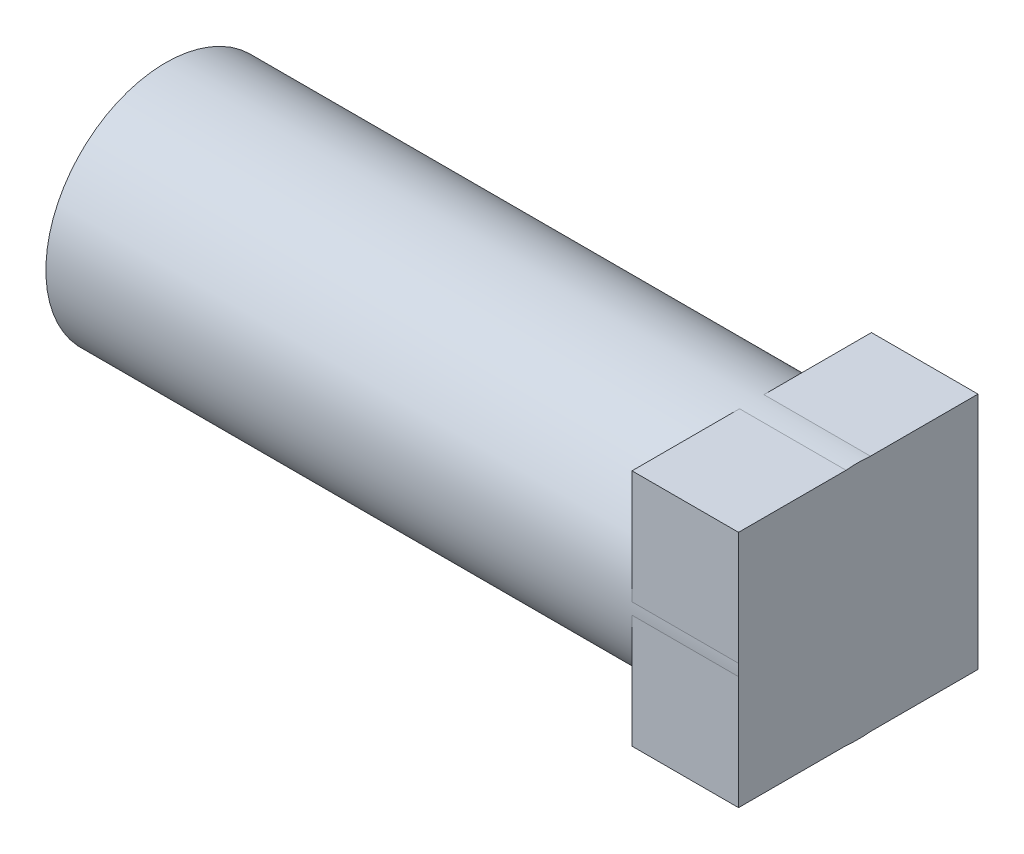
SolidWorks part; units mm, degrees
ref_plane "Front Plane" through (0, 0, 0) normal (0, 0, 1) x (1, 0, 0)
ref_plane "Top Plane" through (0, 0, 0) normal (0, 1, 0) x (1, 0, 0)
ref_plane "Right Plane" through (0, 0, 0) normal (1, 0, 0) x (0, 0, -1)
sketch "Sketch1" plane through (0, 0, 0) normal (1, 0, 0) x (0, 0, -1)
  circle A0 centre (0, 0) radius 2.25
  dimension "D1" = 4.5
extrude "Boss-Extrude1" add sketch "Sketch1" along normal blind 13 contours A0
sketch "Sketch2" plane through (13, 0, 0) normal (1, 0, 0) x (0, 0, -1)
  line L1 (2.2474, -2.2383) -> (-2.2474, -2.2383)
  line L2 (2.2474, -2.2383) -> (2.2474, 2.2383)
  line L3 (2.2474, 2.2383) -> (-2.2474, 2.2383)
  line L4 (-2.2474, -2.2383) -> (-2.2474, 2.2383)
  line L5 (2.2474, -2.2383) -> (-2.2474, 2.2383) construction
  line L6 (2.2474, 2.2383) -> (-2.2474, -2.2383) construction
  point P0 (0, 0)
extrude "Boss-Extrude2" add sketch "Sketch2" against normal blind 2
